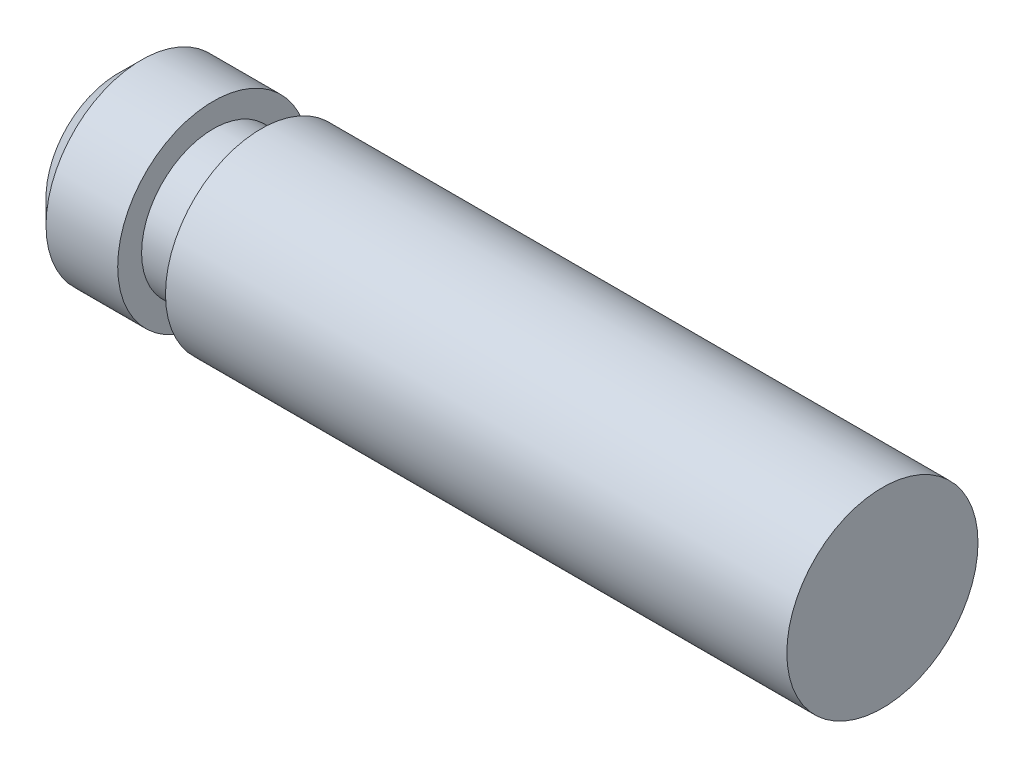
SolidWorks part; units mm, degrees
ref_plane "Plan de face" through (0, 0, 0) normal (0, 0, 1) x (1, 0, 0)
ref_plane "Plan de dessus" through (0, 0, 0) normal (0, 1, 0) x (1, 0, 0)
ref_plane "Plan de droite" through (0, 0, 0) normal (1, 0, 0) x (0, 0, -1)
sketch "Esquisse1" plane through (0, 0, 0) normal (0, 0, 1) x (1, 0, 0)
  line L0 (-29.0102, 0) -> (69.4449, 0) construction
  line L1 (0, 0) -> (0, 2)
  line L2 (0, 2) -> (2, 2)
  line L3 (2, 2) -> (2, 1.5)
  line L4 (2, 1.5) -> (3, 1.5)
  line L5 (3, 1.5) -> (3, 2)
  line L6 (3, 2) -> (16, 2)
  line L7 (16, 2) -> (16, 0)
  line L8 (16, 0) -> (0, 0)
  dimension "D1" = 2
  dimension "D2" = 2
  dimension "D3" = 1.5
  dimension "D4" = 1
  dimension "D5" = 2
  dimension "D6" = 16
revolve "Révolution1" add sketch "Esquisse1" angle 360 about L0
chamfer "Chanfrein1" distance 0.5 angle 45 1 edges at (0, 0, 2)
